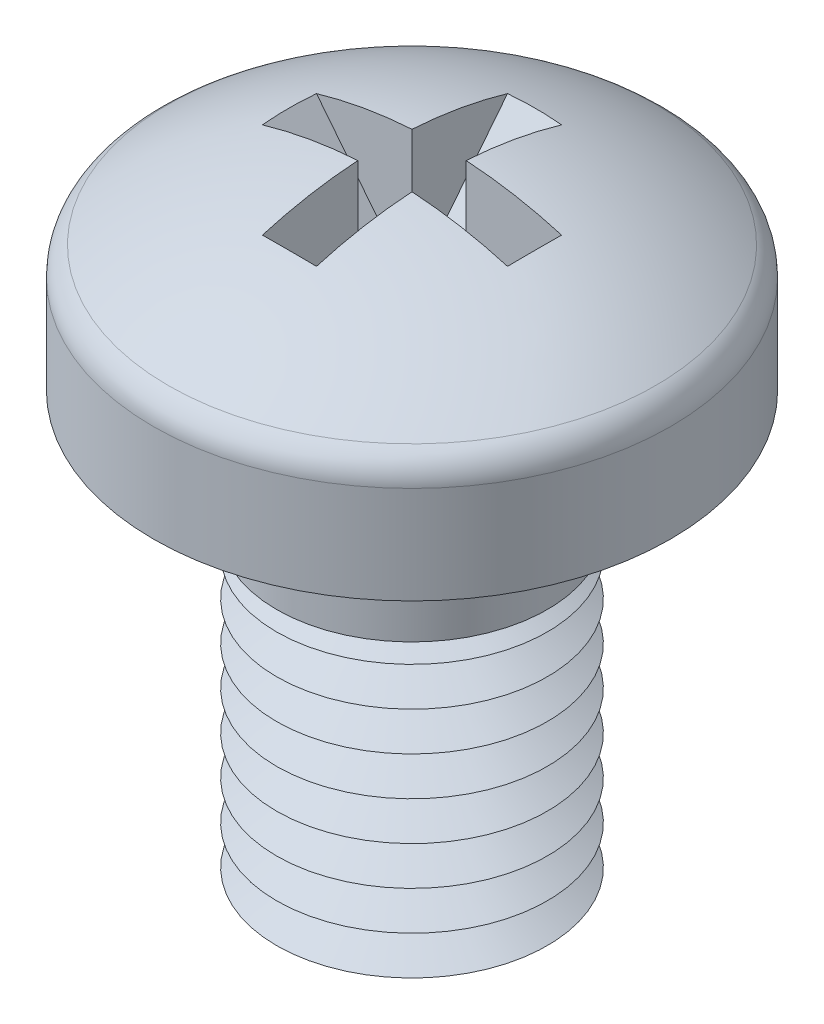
SolidWorks part; units mm, degrees
ref_plane "Front" through (0, 0, 0) normal (0, 0, 1) x (1, 0, 0)
ref_plane "Top" through (0, 0, 0) normal (0, 1, 0) x (1, 0, 0)
ref_plane "Side" through (0, 0, 0) normal (1, 0, 0) x (0, 0, -1)
sketch "Sketch1" plane through (0, 0, 0) normal (0, 0, 1) x (1, 0, 0)
  line L0 (0, 0) -> (4.7765, 0)
  line L1 (4.7765, 0) -> (4.7765, 1.8003)
  line L2 (0, 3.7) -> (0, 0)
  line L3 (0, 0) -> (0, 100) construction
  arc A0 (4.7765, 1.8003) -> (4.5013, 2.319) centre (4.15, 1.8003) ccw
  arc A1 (4.5013, 2.319) -> (0, 3.7) centre (0, -4.3265) ccw
revolve "Base-Revolve" add sketch "Sketch1" angle 360 about L3
sketch "Sketch2" plane through (0, 0, 0) normal (0, 0, 1) x (1, 0, 0)
  line L0 (0, 0) -> (0, 100) construction
  line L1 (0, -8) -> (1.8792, -8)
  line L2 (1.8792, -8) -> (2.5, -7.6416)
  line L3 (2.5, -7.6416) -> (1.8792, -7.2832)
  line L4 (1.8792, -7.2832) -> (2.5, -6.9248)
  line L5 (2.5, -6.9248) -> (1.8792, -6.5664)
  line L6 (1.8792, -6.5664) -> (2.5, -6.208)
  line L7 (2.5, -6.208) -> (1.8792, -5.8496)
  line L8 (1.8792, -5.8496) -> (2.5, -5.4912)
  line L9 (2.5, -5.4912) -> (1.8792, -5.1328)
  line L10 (1.8792, -5.1328) -> (2.5, -4.7744)
  line L11 (2.5, -4.7744) -> (1.8792, -4.416)
  line L12 (1.8792, -4.416) -> (2.5, -4.0575)
  line L13 (2.5, -4.0575) -> (1.8792, -3.6991)
  line L14 (1.8792, -3.6991) -> (2.5, -3.3407)
  line L15 (2.5, -3.3407) -> (1.8792, -2.9823)
  line L16 (1.8792, -2.9823) -> (2.5, -2.6239)
  line L17 (2.5, -2.6239) -> (1.8792, -2.2655)
  line L18 (1.8792, -2.2655) -> (2.5, -2.2655)
  line L19 (2.5, -2.2655) -> (2.5, 0)
  line L20 (2.5, 0) -> (0, 0)
  line L21 (0, 0) -> (0, -8)
revolve "Boss-Revolve1" add sketch "Sketch2" angle 360 about L0
sketch "Sketch3" plane through (0, 0, 0) normal (0, 0, 1) x (1, 0, 0)
  line L0 (-2.535, 5.55) -> (2.535, 5.55)
  line L1 (2.535, 5.55) -> (2.535, 3.7)
  line L2 (2.535, 3.7) -> (0, 0.5)
  line L3 (0, 0.5) -> (-2.535, 3.7)
  line L4 (-2.535, 3.7) -> (-2.535, 5.55)
extrude "Cut-Extrude1" cut sketch "Sketch3" against normal mid plane 1
sketch "Sketch4" plane through (0, 0, 0) normal (1, 0, 0) x (0, 0, -1)
  line L0 (-2.535, 5.55) -> (2.535, 5.55)
  line L1 (2.535, 5.55) -> (2.535, 3.7)
  line L2 (2.535, 3.7) -> (0, 0.5)
  line L3 (0, 0.5) -> (-2.535, 3.7)
  line L4 (-2.535, 3.7) -> (-2.535, 5.55)
extrude "Cut-Extrude2" cut sketch "Sketch4" against normal mid plane 1
